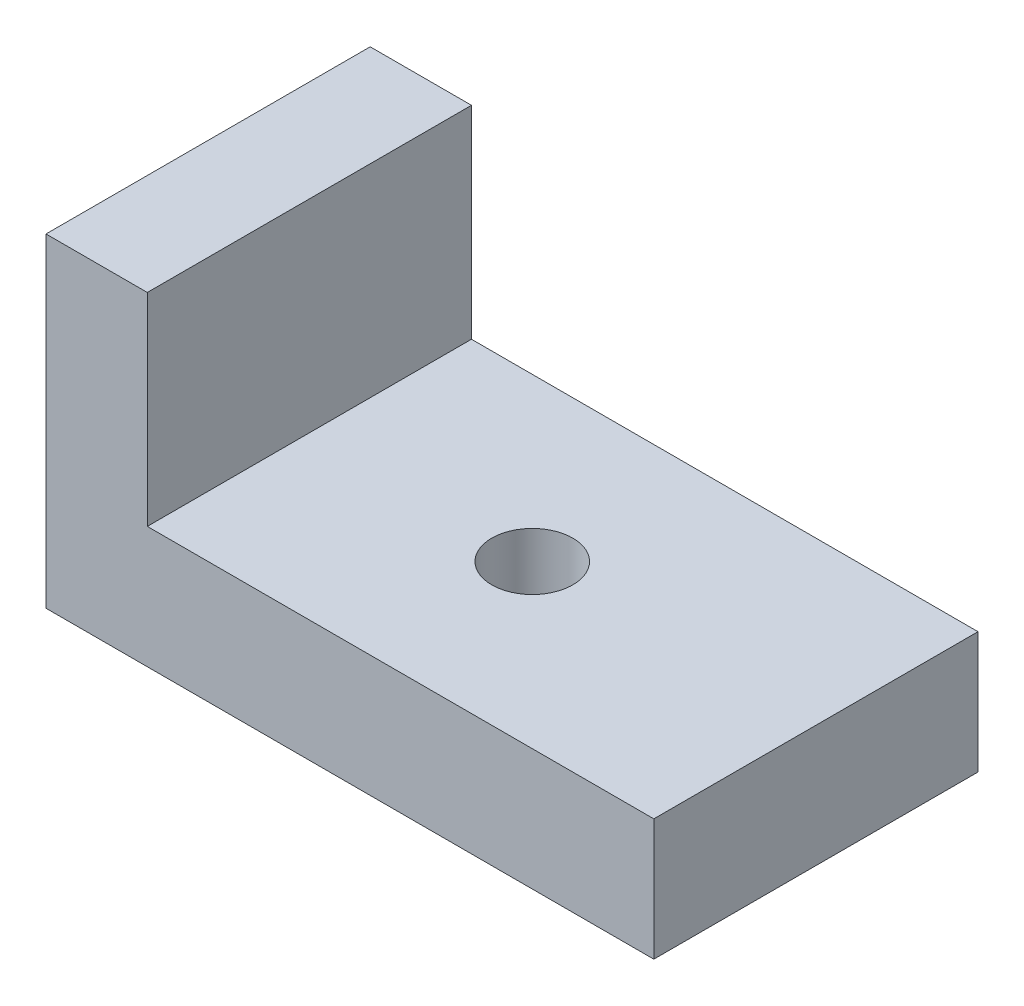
SolidWorks part; units mm, degrees
ref_plane "Ebene vorne" through (0, 0, 0) normal (0, 0, 1) x (1, 0, 0)
ref_plane "Ebene oben" through (0, 0, 0) normal (0, 1, 0) x (1, 0, 0)
ref_plane "Ebene rechts" through (0, 0, 0) normal (1, 0, 0) x (0, 0, -1)
sketch "Skizze1" plane through (0, 0, 0) normal (0, 0, 1) x (1, 0, 0)
sketch_block_instance "Gestell-1"
sketch_block "Gestell" parameters "D1"=128.9284, "D2"=70, "D3"=25, "D4"=30, "D5"=150
extrude "Linear austragen1" add sketch "Skizze1" along normal mid plane 80
sketch "Skizze2" plane through (0, 21.4863, 0) normal (0, 1, 0) x (-1, 0, 0)
  line L0 (60.5, 0) -> (-60.5, 0) construction
  line L1 (37.5599, 40) -> (37.5599, -40) construction
  circle A0 centre (-17.4401, 0) radius 10
  dimension "D1" = 20
  dimension "D2" = 55
extrude "Schnitt-Linear austragen1" cut sketch "Skizze2" against normal blind 80
